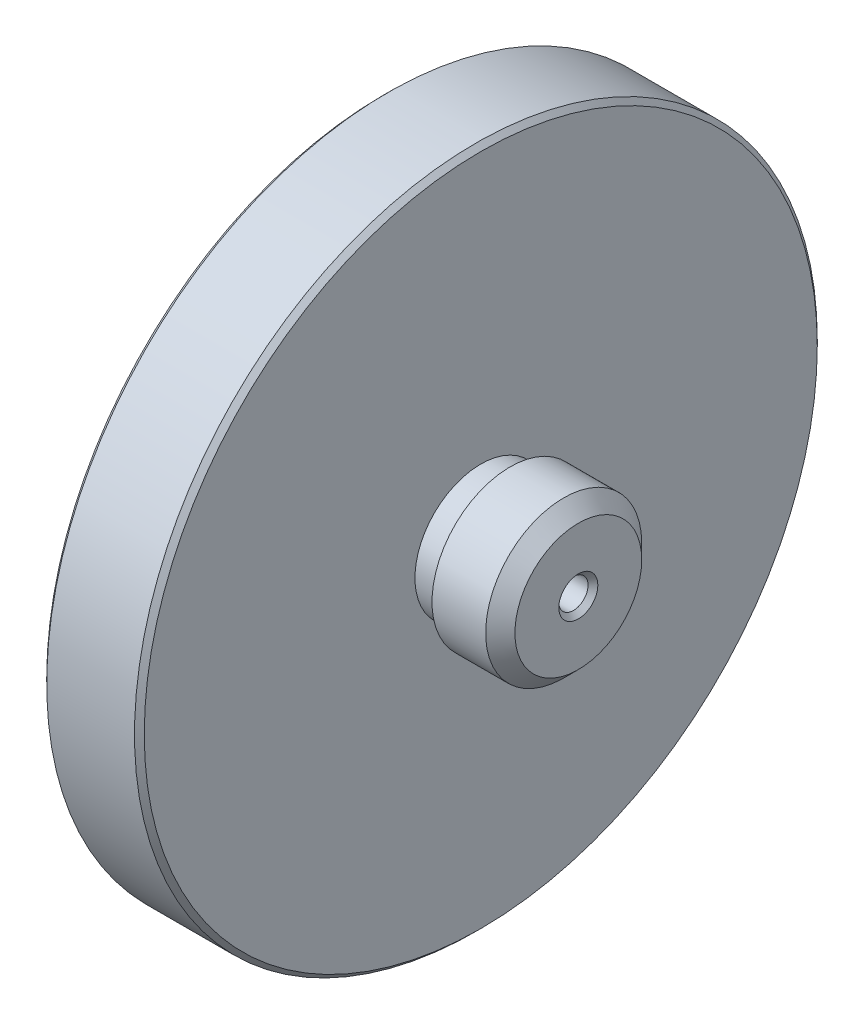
SolidWorks part; units mm, degrees
ref_plane "Спереди" through (0, 0, 0) normal (0, 0, 1) x (1, 0, 0)
ref_plane "Сверху" through (0, 0, 0) normal (0, 1, 0) x (1, 0, 0)
ref_plane "Справа" through (0, 0, 0) normal (1, 0, 0) x (0, 0, -1)
sketch "Эскиз1" plane through (0, 0, 0) normal (1, 0, 0) x (0, 0, -1)
  line L0 (-102.1605, 0) -> (122.9062, 0) construction
  line L1 (0, 71.7656) -> (0, -69.8358) construction
  circle A0 centre (0, 0) radius 35
  dimension "D1" = 70
extrude "Вытянуть1" add sketch "Эскиз1" along normal blind 10
sketch "Эскиз2" plane through (10, 0, 0) normal (1, 0, 0) x (0, 0, -1)
  circle A0 centre (0, 0) radius 8
  dimension "D1" = 16
extrude "Вытянуть2" add sketch "Эскиз2" along normal blind 10
sketch "Эскиз3" plane through (20, 0, 0) normal (1, 0, 0) x (0, 0, -1)
  circle A0 centre (0, 0) radius 4.375
  dimension "D1" = 8.75
extrude "Вырез-Вытянуть1" cut sketch "Эскиз3" against normal through all
chamfer "Фаска1" distance 0.5 angle 45 3 edges at (0, 0, -4.375) (0, 0, -35) (10, 0, -35)
sketch "Эскиз4" plane through (10, 0, 0) normal (1, 0, 0) x (0, 0, -1)
  circle A0 centre (0, 0) radius 6.75
  dimension "D1" = 13.5
extrude "Вырез-Вытянуть2" cut sketch "Эскиз4" along normal blind 3 flip side to cut
chamfer "Фаска2" distance 1.5 angle 45 1 edges at (20, 0, -8)
sketch "Эскиз5" plane through (20, 0, 0) normal (1, 0, 0) x (0, 0, -1)
  circle A0 centre (0, 0) radius 5
  dimension "D1" = 10
extrude "Вытянуть3" add sketch "Эскиз5" against normal blind 4
sketch "Эскиз6" plane through (20, 0, 0) normal (1, 0, 0) x (0, 0, -1)
  circle A0 centre (0, 0) radius 1.5
  dimension "D1" = 3
extrude "Вырез-Вытянуть3" cut sketch "Эскиз6" against normal blind 4
chamfer "Фаска3" distance 0.5 angle 45 2 edges at (16, 0, -1.5) (20, 0, -1.5)
